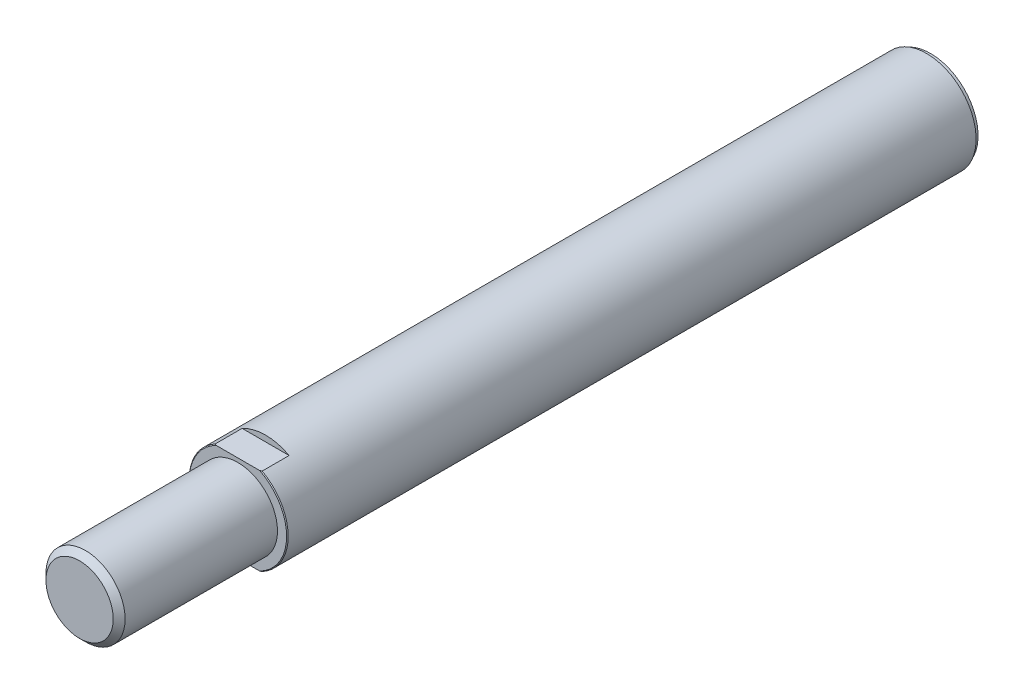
SolidWorks part; units mm, degrees
ref_plane "Plano frontal" through (0, 0, 0) normal (0, 0, 1) x (1, 0, 0)
ref_plane "Plano superior" through (0, 0, 0) normal (0, 1, 0) x (1, 0, 0)
ref_plane "Plano direito" through (0, 0, 0) normal (1, 0, 0) x (0, 0, -1)
sketch "Esboço1" plane through (0, 0, 0) normal (0, 0, 1) x (1, 0, 0)
  circle A0 centre (0, 0) radius 12.5
  dimension "D1" = 25
extrude "Ressalto-extrusão1" add sketch "Esboço1" along normal blind 215
sketch "Esboço2" plane through (0, 0, 215) normal (0, 0, 1) x (1, 0, 0)
  circle A0 centre (0, 0) radius 10
  dimension "D1" = 20
extrude "Corte-extrusão1" cut sketch "Esboço2" against normal blind 40 flip side to cut
chamfer "Chanfro1" distance 0.2 angle 45 1 edges at (12.5, 0, 175)
sketch "Esboço3" plane through (0, 0, 175) normal (0, 0, 1) x (1, 0, 0)
  line L1 (-18.9676, -11) -> (18.9676, -11)
  line L2 (-18.9676, -11) -> (-18.9676, 11)
  line L3 (-18.9676, 11) -> (18.9676, 11)
  line L4 (18.9676, -11) -> (18.9676, 11)
  line L5 (-18.9676, -11) -> (18.9676, 11) construction
  line L6 (-18.9676, 11) -> (18.9676, -11) construction
  point P0 (0, 0)
  dimension "D1" = 22
extrude "Corte-extrusão2" cut sketch "Esboço3" against normal blind 7 flip side to cut
chamfer "Chanfro2" distance 1.5 angle 45 1 edges at (10, 0, 215)
sketch "Esboço4" plane through (0, 0, 0) normal (0, 0, -1) x (-1, 0, 0)
  circle A0 centre (0, 0) radius 12
  dimension "D1" = 24
extrude "Corte-extrusão3" cut sketch "Esboço4" against normal blind 1 flip side to cut
hole_wizard "Furo roscado de M12x1.751" positions "Esboço5" profile "Esboço6" tap size "M12x1.75" standard "Ansi Metric"
sketch "Esboço5" plane through (0, 0, 0) normal (0, 0, -1) x (-1, 0, 0)
  point P0 (0, 0)
sketch "Esboço6" plane through (0, 0, 0) normal (1, 0, 0) x (0, 1, 0)
  line L0 (0, 0) -> (0, 35.8144)
  line L1 (0, 35.8144) -> (5.1, 32.75)
  line L2 (5.1, 32.75) -> (5.1, 0)
  line L5 (5.1, 0) -> (0, 0)
  line L10 (0, 35.8144) -> (-5.1, 32.75) construction
  line L11 (0, -6.35) -> (0, 107.95) construction
  dimension "Tap Drill Dia." = 10.2
  dimension "Tap Drill Depth" = 32.75
  dimension "Drill Angle" = 118
